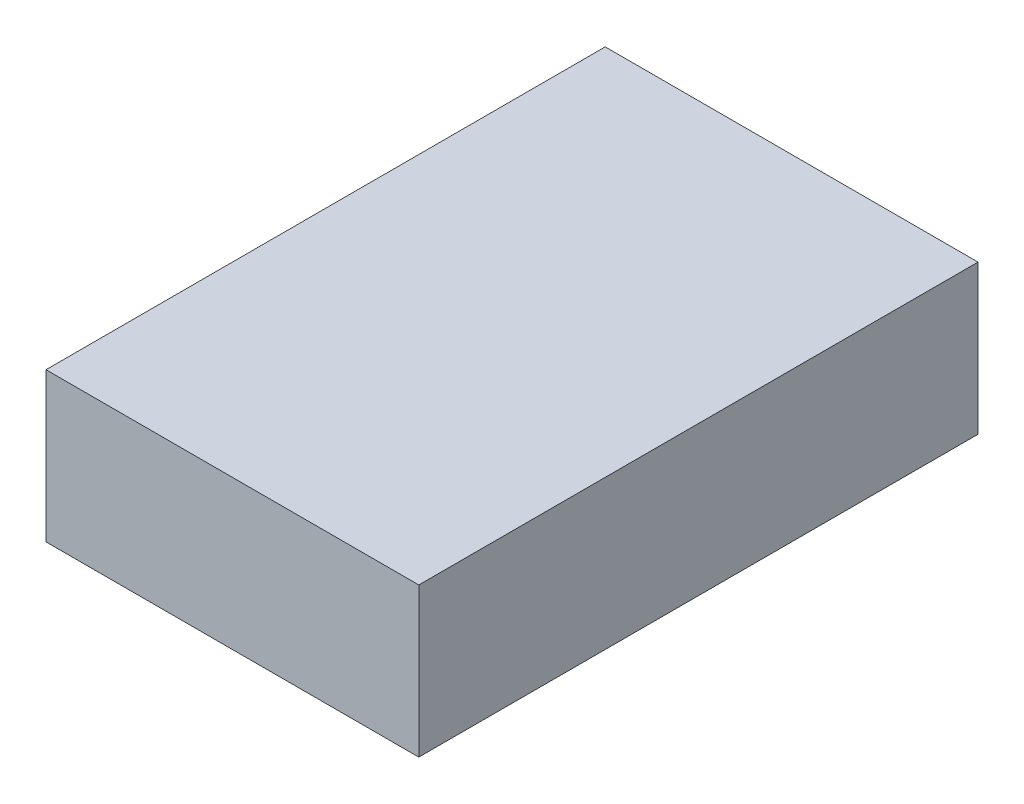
SolidWorks part; units mm, degrees
ref_plane "前视基准面" through (0, 0, 0) normal (0, 0, 1) x (1, 0, 0)
ref_plane "上视基准面" through (0, 0, 0) normal (0, 1, 0) x (1, 0, 0)
ref_plane "右视基准面" through (0, 0, 0) normal (1, 0, 0) x (0, 0, -1)
sketch "草图1" plane through (0, 0, 0) normal (0, 0, 1) x (1, 0, 0)
  line L1 (-10, -4) -> (10, -4)
  line L2 (-10, -4) -> (-10, 4)
  line L3 (-10, 4) -> (10, 4)
  line L4 (10, -4) -> (10, 4)
  line L5 (-10, -4) -> (10, 4) construction
  line L6 (-10, 4) -> (10, -4) construction
  point P0 (0, 0)
  dimension "D1" = 8
  dimension "D2" = 20
extrude "凸台-拉伸1" add sketch "草图1" along normal blind 30
